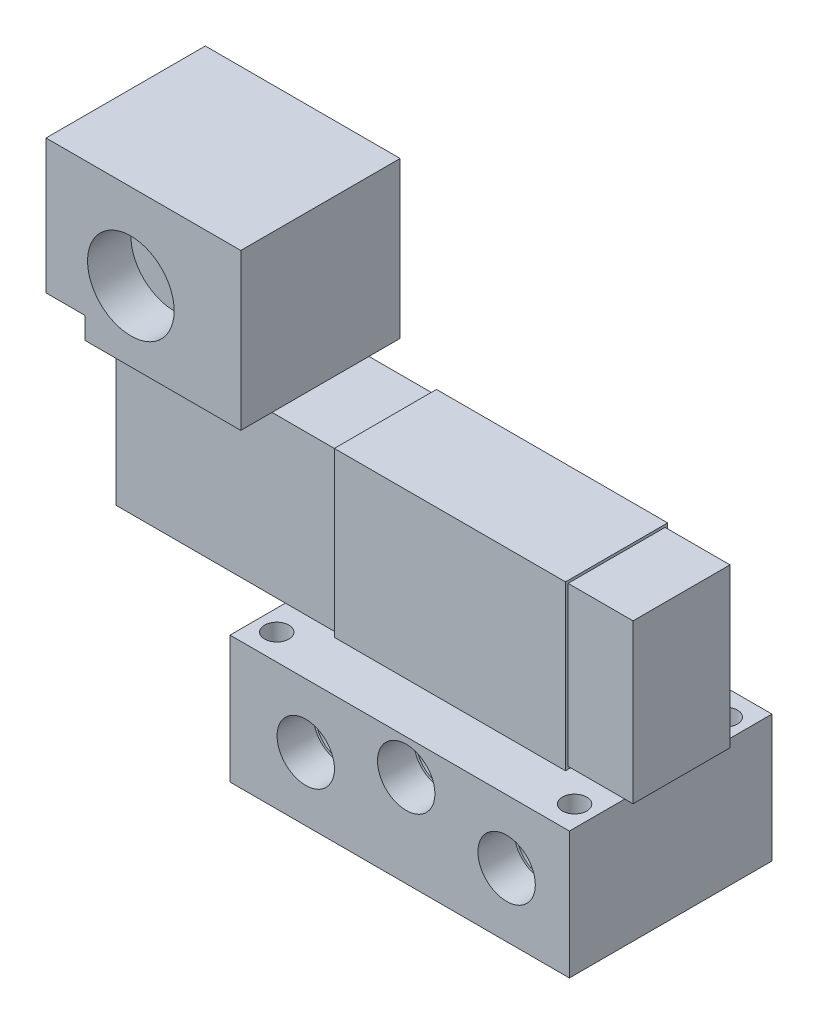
SolidWorks part; units mm, degrees
extrude "Base-Extrude" add sketch "Sketch1" along normal mid plane 59.436
sketch "Sketch1" plane through (0, 0, 0) normal (0, 0, 1) x (1, 0, 0)
  line L0 (0, 37.338) -> (99.568, 37.338)
  line L1 (0, 37.338) -> (0, 0)
  line L2 (99.568, 0) -> (0, 0)
  line L3 (99.568, 0) -> (99.568, 37.338)
  dimension "D1" = 99.568
  dimension "D2" = 37.338
ref_plane "Front" through (0, 0, 0) normal (0, 0, 1) x (1, 0, 0)
ref_plane "Top" through (0, 0, 0) normal (0, 1, 0) x (1, 0, 0)
ref_plane "Right" through (0, 0, 0) normal (1, 0, 0) x (0, 0, -1)
sketch "Sketch2" plane through (0, 37.338, 0) normal (0, 1, 0) x (-1, 0, 0)
  line L0 (-15.875, 14.986) -> (-83.693, 14.986)
  line L1 (-15.875, 14.986) -> (-15.875, -14.986)
  line L2 (-83.693, -14.986) -> (-15.875, -14.986)
  line L3 (-83.693, -14.986) -> (-83.693, 14.986)
  line L4 (0, 0) -> (-15.875, 0) construction
  line L5 (-99.568, 29.718) -> (-99.568, -29.718) construction
  line L6 (0, 29.718) -> (0, -29.718) construction
  dimension "D1" = 29.972
  dimension "D2" = 15.875
  dimension "D3" = 15.875
extrude "Boss-Extrude1" add sketch "Sketch2" along normal blind 48.006
sketch "Sketch3" plane through (83.693, 0, 0) normal (1, 0, 0) x (0, 0, -1)
  line L8 (-14.224, 38.1) -> (14.224, 38.1)
  line L9 (14.224, 38.1) -> (14.224, 84.582)
  line L10 (14.224, 84.582) -> (-14.224, 84.582)
  line L11 (-14.224, 84.582) -> (-14.224, 38.1)
  line L12 (-14.224, 38.1) -> (14.224, 38.1)
  line L13 (14.224, 38.1) -> (14.224, 84.582)
  line L14 (14.224, 84.582) -> (-14.224, 84.582)
  line L15 (-14.224, 84.582) -> (-14.224, 38.1)
  dimension "D1" = 0.762
extrude "Boss-Extrude2" add sketch "Sketch3" along normal blind 19.05
ref_plane "Plane4" through (-48.895, 0, 0) normal (1, 0, 0) x (0, 0, -1)
sketch "Sketch4" plane through (15.875, 0, 0) normal (-1, 0, 0) x (0, 0, 1)
  line L4 (14.224, 84.582) -> (14.224, 38.1)
  line L5 (14.224, 38.1) -> (-14.224, 38.1)
  line L6 (-14.224, 38.1) -> (-14.224, 84.582)
  line L7 (-14.224, 84.582) -> (14.224, 84.582)
  line L8 (14.224, 84.582) -> (14.224, 38.1)
  line L9 (14.224, 38.1) -> (-14.224, 38.1)
  line L10 (-14.224, 38.1) -> (-14.224, 84.582)
  line L11 (-14.224, 84.582) -> (14.224, 84.582)
  dimension "D1" = 0
extrude "Boss-Extrude4" add sketch "Sketch4" along normal up to surface (64.77 mm away)
sketch "Sketch5" plane through (0, 0, 0) normal (0, 0, 1) x (1, 0, 0)
  line L0 (-60.325, 130.302) -> (-3.175, 130.302)
  line L1 (-3.175, 130.302) -> (-3.175, 84.582)
  line L2 (-48.895, 84.582) -> (15.875, 84.582) construction
  line L3 (-3.175, 84.582) -> (-48.895, 84.582)
  line L4 (-48.895, 84.582) -> (-48.895, 90.932)
  line L5 (-48.895, 90.932) -> (-60.325, 90.932)
  line L6 (-60.325, 90.932) -> (-60.325, 130.302)
  line L8 (-48.895, 38.1) -> (15.875, 38.1) construction
  line L9 (25.527, 125.2795) -> (25.527, 84.582) construction
  line L10 (-48.895, 38.1) -> (-48.895, 84.582) construction
  line L11 (0, 37.338) -> (0, 0) construction
  line L12 (27.559, 123.5651) -> (27.559, 6.0315) construction
  line L13 (81.153, 18.669) -> (22.225, 18.669) construction
  line L14 (0, 18.669) -> (22.225, 18.669) construction
  point P19 (51.689, 27.051)
  dimension "D1" = 92.202
  dimension "D2" = 74.422
  dimension "D3" = 85.852
  dimension "D4" = 3.175
  dimension "D5" = 6.35
  dimension "D6" = 2.032
  dimension "D7" = 8.382
  dimension "D8" = 24.13
  dimension "D9" = 53.594
  dimension "D10" = 5.334
extrude "Boss-Extrude5" add sketch "Sketch5" along normal mid plane 46.736
sketch "Sketch6" plane through (0, 0, 23.368) normal (0, 0, 1) x (1, 0, 0)
  line L0 (-60.325, 90.932) -> (-60.325, 130.302) construction
  line L1 (-60.325, 130.302) -> (-3.175, 130.302) construction
  circle A0 centre (-35.433, 105.156) radius 12.7
  dimension "D1" = 25.4
  dimension "D2" = 24.892
  dimension "D3" = 25.146
extrude "Cut-Extrude1" cut sketch "Sketch6" against normal blind 12.7
sketch "Sketch7" plane through (-71.2361, 3.3714, -23.368) normal (0, 0, -1) x (-1, 0, 0)
  line L3 (-10.9111, 87.5606) -> (-10.9111, 126.9306) construction
  line L4 (-10.9111, 126.9306) -> (-68.0611, 126.9306) construction
  circle A0 centre (-35.8031, 101.7846) radius 12.7
  dimension "D1" = 25.4
  dimension "D2" = 24.892
  dimension "D3" = 25.146
extrude "Cut-Extrude2" cut sketch "Sketch7" against normal blind 12.7
sketch "Sketch8" plane through (50.5417, 21.5885, 29.718) normal (0, 0, 1) x (1, 0, 0)
  circle A0 centre (1.1473, 5.4625) radius 8.4201
  dimension "Pipe OD" = 16.8402
extrude "Cut-Extrude3" cut sketch "Sketch8" against normal blind 10.3378 draft 1.783
sketch "Sketch9" plane through (50.5417, 21.5885, 29.718) normal (0, 0, 1) x (1, 0, 0)
  circle A0 centre (1.1473, 5.4625) radius 7.3406
  dimension "D1" = 14.6812
extrude "Cut-Extrude4" cut sketch "Sketch9" against normal blind 25.4
sketch "Sketch10" plane through (50.5417, 21.5885, 4.318) normal (0, 0, 1) x (1, 0, 0)
  circle A1 centre (1.1473, 5.4625) radius 7.3406
  circle A2 centre (1.1473, 5.4625) radius 7.3406
  dimension "D1" = 0
extrude "Cut-Extrude5" cut sketch "Sketch10" against normal up to next draft 60
sketch "Sketch11" plane through (50.5417, 21.5885, 19.3802) normal (0, 0, 1) x (1, 0, 0)
  circle A1 centre (1.1473, 5.4625) radius 8.0982
  circle A2 centre (1.1473, 5.4625) radius 8.0982
  dimension "D1" = 0
other ".25 NPT1"
sketch "Sketch12" plane through (83.3095, 17.1618, 29.718) normal (0, 0, 1) x (1, 0, 0)
  circle A0 centre (-2.1565, 1.5072) radius 8.4201
  dimension "Pipe OD" = 16.8402
extrude "Cut-Extrude6" cut sketch "Sketch12" against normal blind 10.3378 draft 1.783
sketch "Sketch13" plane through (81.153, 18.669, 29.718) normal (0, 0, 1) x (1, 0, 0)
  circle A0 centre (0, 0) radius 7.3406
  dimension "D1" = 14.6812
extrude "Cut-Extrude7" cut sketch "Sketch13" against normal blind 25.4
sketch "Sketch14" plane through (81.153, 18.669, 4.318) normal (0, 0, 1) x (1, 0, 0)
  circle A1 centre (0, 0) radius 7.3406
  circle A2 centre (0, 0) radius 7.3406
  dimension "D1" = 0
extrude "Cut-Extrude8" cut sketch "Sketch14" against normal up to next draft 60
sketch "Sketch15" plane through (81.153, 18.669, 19.3802) normal (0, 0, 1) x (1, 0, 0)
  circle A1 centre (0, 0) radius 8.0982
  circle A2 centre (0, 0) radius 8.0982
  dimension "D1" = 0
other ".25 NPT2"
sketch "Sketch16" plane through (17.6661, 14.0196, 29.718) normal (0, 0, 1) x (1, 0, 0)
  circle A0 centre (4.5589, 4.6494) radius 8.4201
  dimension "Pipe OD" = 16.8402
extrude "Cut-Extrude9" cut sketch "Sketch16" against normal blind 10.3378 draft 1.783
sketch "Sketch17" plane through (0, 18.669, 29.718) normal (0, 0, 1) x (1, 0, 0)
  circle A0 centre (22.225, 0) radius 7.3406
  dimension "D1" = 14.6812
extrude "Cut-Extrude10" cut sketch "Sketch17" against normal blind 25.4
sketch "Sketch18" plane through (0, 18.669, 4.318) normal (0, 0, 1) x (1, 0, 0)
  arc A1 (29.5656, 0) -> (29.5656, 0) centre (22.225, 0) ccw
  circle A2 centre (22.225, 0) radius 7.3406
  dimension "D1" = 0
extrude "Cut-Extrude11" cut sketch "Sketch18" against normal up to next draft 60
sketch "Sketch19" plane through (0, 18.669, 19.3802) normal (0, 0, 1) x (1, 0, 0)
  circle A1 centre (22.225, 0) radius 8.0982
  circle A2 centre (22.225, 0) radius 8.0982
  dimension "D1" = 0
other ".25 NPT3"
sketch "Sketch20" plane through (79.9248, 17.4414, -29.718) normal (0, 0, -1) x (-1, 0, 0)
  circle A0 centre (-1.2282, 1.2276) radius 8.4201
  dimension "Pipe OD" = 16.8402
extrude "Cut-Extrude12" cut sketch "Sketch20" against normal blind 10.3378 draft 1.783
sketch "Sketch21" plane through (81.153, 18.669, -29.718) normal (0, 0, -1) x (-1, 0, 0)
  circle A0 centre (0, 0) radius 7.3406
  dimension "D1" = 14.6812
extrude "Cut-Extrude13" cut sketch "Sketch21" against normal blind 25.4
sketch "Sketch22" plane through (81.153, 18.669, -4.318) normal (0, 0, -1) x (-1, 0, 0)
  circle A1 centre (0, 0) radius 7.3406
  circle A2 centre (0, 0) radius 7.3406
  dimension "D1" = 0
extrude "Cut-Extrude14" cut sketch "Sketch22" against normal up to next draft 60
sketch "Sketch23" plane through (81.153, 18.669, -19.3802) normal (0, 0, -1) x (-1, 0, 0)
  circle A1 centre (0, 0) radius 8.0982
  circle A2 centre (0, 0) radius 8.0982
  dimension "D1" = 0
other ".25 NPT4"
sketch "Sketch24" plane through (54.6459, 14.0804, -29.718) normal (0, 0, -1) x (-1, 0, 0)
  circle A0 centre (2.9569, 12.9706) radius 8.4201
  dimension "Pipe OD" = 16.8402
extrude "Cut-Extrude15" cut sketch "Sketch24" against normal blind 10.3378 draft 1.783
sketch "Sketch25" plane through (51.689, 27.051, -29.718) normal (0, 0, -1) x (-1, 0, 0)
  circle A0 centre (0, 0) radius 7.3406
  dimension "D1" = 14.6812
extrude "Cut-Extrude16" cut sketch "Sketch25" against normal blind 25.4
sketch "Sketch26" plane through (51.689, 27.051, -4.318) normal (0, 0, -1) x (-1, 0, 0)
  circle A1 centre (0, 0) radius 7.3406
  circle A2 centre (0, 0) radius 7.3406
  dimension "D1" = 0
extrude "Cut-Extrude17" cut sketch "Sketch26" against normal up to next draft 60
sketch "Sketch27" plane through (51.689, 27.051, -19.3802) normal (0, 0, -1) x (-1, 0, 0)
  circle A1 centre (0, 0) radius 8.0982
  circle A2 centre (0, 0) radius 8.0982
  dimension "D1" = 0
other ".25 NPT5"
sketch "Sketch28" plane through (17.8391, 17.324, -29.718) normal (0, 0, -1) x (-1, 0, 0)
  circle A0 centre (-4.3859, 1.345) radius 8.4201
  dimension "Pipe OD" = 16.8402
extrude "Cut-Extrude18" cut sketch "Sketch28" against normal blind 10.3378 draft 1.783
sketch "Sketch29" plane through (22.225, 18.669, -29.718) normal (0, 0, -1) x (-1, 0, 0)
  circle A0 centre (0, 0) radius 7.3406
  dimension "D1" = 14.6812
extrude "Cut-Extrude19" cut sketch "Sketch29" against normal blind 25.4
sketch "Sketch30" plane through (22.225, 18.669, -4.318) normal (0, 0, -1) x (-1, 0, 0)
  circle A1 centre (0, 0) radius 7.3406
  circle A2 centre (0, 0) radius 7.3406
  dimension "D1" = 0
extrude "Cut-Extrude20" cut sketch "Sketch30" against normal up to next draft 60
sketch "Sketch31" plane through (22.225, 18.669, -19.3802) normal (0, 0, -1) x (-1, 0, 0)
  circle A1 centre (0, 0) radius 8.0982
  circle A2 centre (0, 0) radius 8.0982
  dimension "D1" = 0
other ".25 NPT6"
sketch "Sketch32" plane through (0, 37.338, 0) normal (0, 1, 0) x (-1, 0, 0)
  line L0 (-99.568, 29.718) -> (-99.568, -29.718) construction
  line L1 (0, 29.718) -> (-99.568, 29.718) construction
  circle A0 centre (-93.472, 22.098) radius 3.5687
extrude "Cut-Extrude21" cut sketch "Sketch32" against normal through all
pattern_linear "LPattern1" count 2 spacing 87.376 along (-1, 0, 0) count 2 spacing 44.196 along (0, 0, -1) of "Cut-Extrude21"
equation "\"D3@Sketch32\" = (\"D1@Base-Extrude\"-1.74)/2"
equation "\"D2@Sketch32\"=(\"D1@Sketch1\"-3.44)/2"
